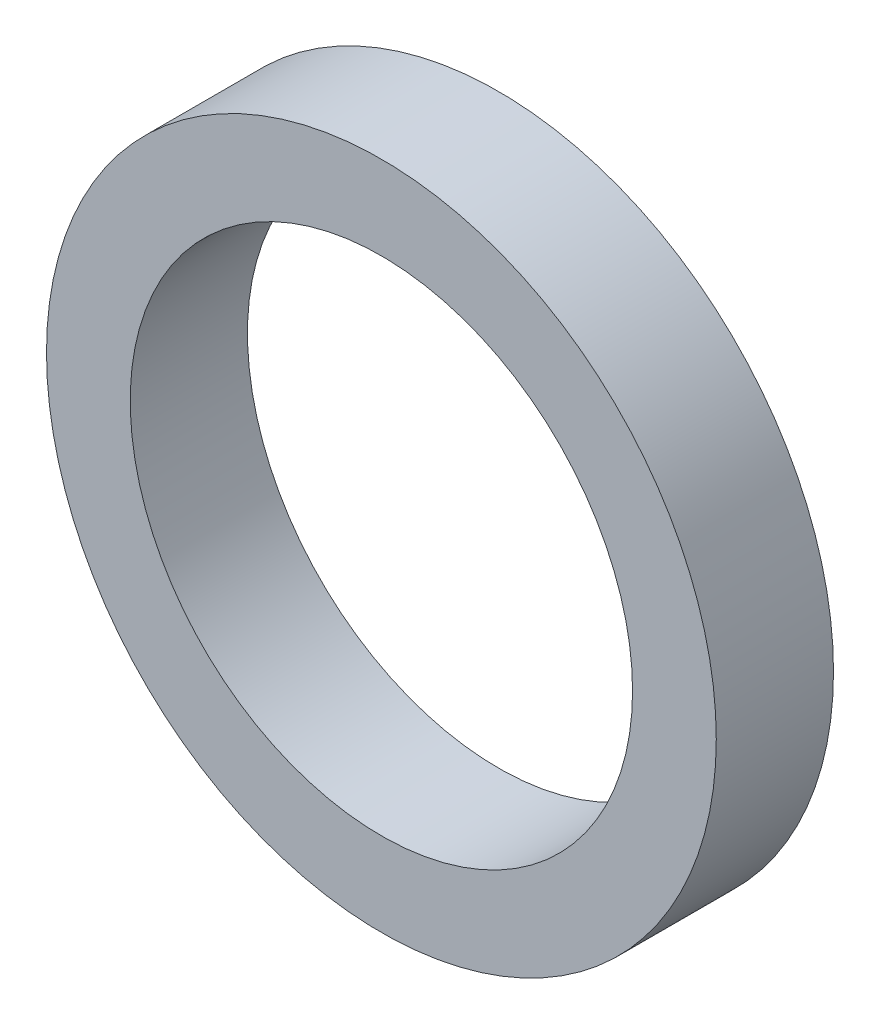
SolidWorks part; units mm, degrees
ref_plane "frontal" through (0, 0, 0) normal (0, 0, 1) x (1, 0, 0)
ref_plane "horizontal" through (0, 0, 0) normal (0, 1, 0) x (1, 0, 0)
ref_plane "profil" through (0, 0, 0) normal (1, 0, 0) x (0, 0, -1)
sketch "Esquisse1" plane through (0, 0, 0) normal (0, 0, 1) x (1, 0, 0)
  circle A0 centre (0, 0) radius 15
  circle A1 centre (0, 0) radius 20
  dimension "D1" = 30
  dimension "D2" = 40
extrude "bague" add sketch "Esquisse1" along normal blind 7
